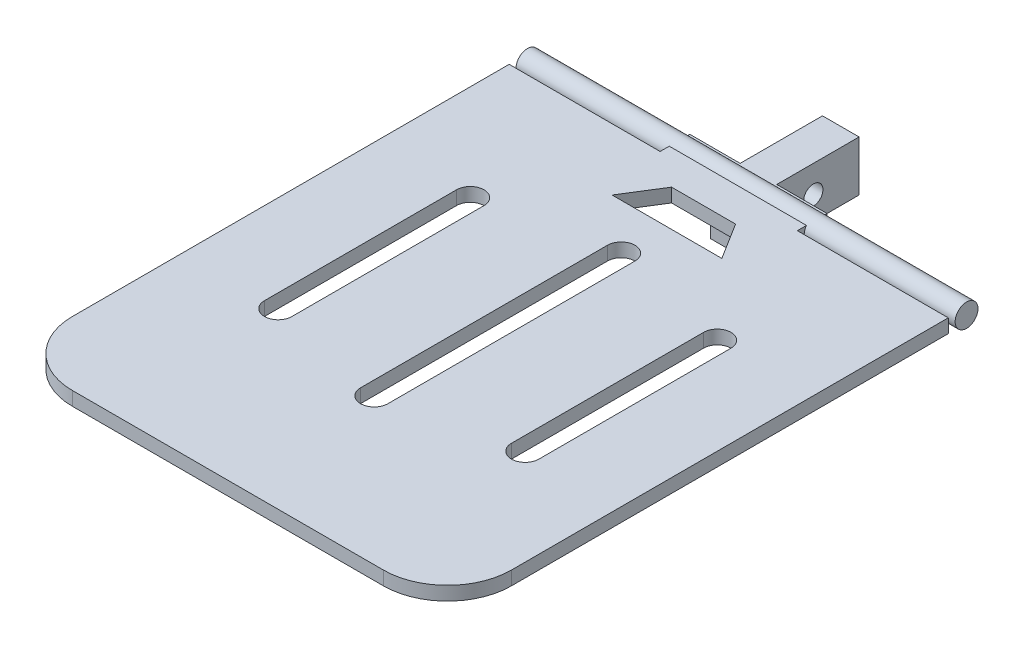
SolidWorks part; units mm, degrees
ref_plane "前视基准面" through (0, 0, 0) normal (0, 0, 1) x (1, 0, 0)
ref_plane "上视基准面" through (0, 0, 0) normal (0, 1, 0) x (1, 0, 0)
ref_plane "右视基准面" through (0, 0, 0) normal (1, 0, 0) x (0, 0, -1)
other "Configuration Table"
ref_plane "Plane_Plate_Mid" through (0, 4.5, 0) normal (0, 1, 0) x (1, 0, 0)
ref_plane "Plane_Tab_Mid" through (0, 0.5, 0) normal (0, 1, 0) x (1, 0, 0)
sketch "草图1" plane through (0, 4.5, 0) normal (0, 1, 0) x (1, 0, 0)
  line L0 (-48, -14.5) -> (48, -14.5)
  line L1 (48, -14.5) -> (48, -110)
  line L2 (34, -124) -> (-34, -124)
  line L3 (-48, -110) -> (-48, -14.5)
  arc A0 (48, -110) -> (34, -124) centre (34, -110) cw
  arc A1 (-34, -124) -> (-48, -110) centre (-34, -110) cw
extrude "01_PLATE_BODY" add sketch "草图1" against normal mid plane 3
sketch "草图2" plane through (0, 0, 0) normal (1, 0, 0) x (0, 0, -1)
  circle A0 centre (-10.5, 4.5) radius 2.5
extrude "02_EDGE_BEAD_D5" add sketch "草图2" against normal mid plane 96
sketch "草图3" plane through (0, 4.5, 0) normal (0, 1, 0) x (1, 0, 0)
  line L1 (-15, -16) -> (15, -16)
  line L2 (-15, -16) -> (-15, -8)
  line L3 (-15, -8) -> (15, -8)
  line L4 (15, -16) -> (15, -8)
extrude "03_WEB" add sketch "草图3" against normal mid plane 3
sketch "草图4" plane through (0, 0.5, 0) normal (0, 1, 0) x (1, 0, 0)
  line L1 (-4, -14.5) -> (4, -14.5)
  line L2 (-4, -14.5) -> (-4, 10)
  line L3 (-4, 10) -> (4, 10)
  line L4 (4, -14.5) -> (4, 10)
extrude "04_TAB" add sketch "草图4" against normal mid plane 11
sketch "草图5" plane through (0, 4.5, 0) normal (0, 1, 0) x (1, 0, 0)
  line L0 (0, -38) -> (0, -92) construction
  line L1 (3, -38) -> (3, -92)
  line L2 (-3, -38) -> (-3, -92)
  arc A0 (3, -38) -> (-3, -38) centre (0, -38) ccw
  arc A1 (-3, -92) -> (3, -92) centre (0, -92) ccw
  point P3 (0, -65)
  point P8 (0, 0)
extrude "05_SLOT_1_F" cut sketch "草图5" along normal through all
sketch "草图6" plane through (0, 4.5, 0) normal (0, 1, 0) x (1, 0, 0)
  line L0 (0, -38) -> (0, -92) construction
  line L1 (3, -38) -> (3, -92)
  line L2 (-3, -38) -> (-3, -92)
  arc A0 (3, -38) -> (-3, -38) centre (0, -38) ccw
  arc A1 (-3, -92) -> (3, -92) centre (0, -92) ccw
  point P3 (0, -65)
  point P8 (0, 0)
extrude "05_SLOT_1_B" cut sketch "草图6" against normal through all
sketch "草图7" plane through (0, 4.5, 0) normal (0, 1, 0) x (1, 0, 0)
  line L0 (-27, -44) -> (-27, -86) construction
  line L1 (-24, -44) -> (-24, -86)
  line L2 (-30, -44) -> (-30, -86)
  arc A0 (-24, -44) -> (-30, -44) centre (-27, -44) ccw
  arc A1 (-30, -86) -> (-24, -86) centre (-27, -86) ccw
  point P2 (-27, -65)
  point P7 (0, 0)
extrude "05_SLOT_2_F" cut sketch "草图7" along normal through all
sketch "草图8" plane through (0, 4.5, 0) normal (0, 1, 0) x (1, 0, 0)
  line L0 (-27, -44) -> (-27, -86) construction
  line L1 (-24, -44) -> (-24, -86)
  line L2 (-30, -44) -> (-30, -86)
  arc A0 (-24, -44) -> (-30, -44) centre (-27, -44) ccw
  arc A1 (-30, -86) -> (-24, -86) centre (-27, -86) ccw
  point P2 (-27, -65)
  point P7 (0, 0)
extrude "05_SLOT_2_B" cut sketch "草图8" against normal through all
sketch "草图9" plane through (0, 4.5, 0) normal (0, 1, 0) x (1, 0, 0)
  line L0 (27, -44) -> (27, -86) construction
  line L1 (30, -44) -> (30, -86)
  line L2 (24, -44) -> (24, -86)
  arc A0 (30, -44) -> (24, -44) centre (27, -44) ccw
  arc A1 (24, -86) -> (30, -86) centre (27, -86) ccw
  point P2 (27, -65)
  point P7 (0, 0)
extrude "05_SLOT_3_F" cut sketch "草图9" along normal through all
sketch "草图10" plane through (0, 4.5, 0) normal (0, 1, 0) x (1, 0, 0)
  line L0 (27, -44) -> (27, -86) construction
  line L1 (30, -44) -> (30, -86)
  line L2 (24, -44) -> (24, -86)
  arc A0 (30, -44) -> (24, -44) centre (27, -44) ccw
  arc A1 (24, -86) -> (30, -86) centre (27, -86) ccw
  point P2 (27, -65)
  point P7 (0, 0)
extrude "05_SLOT_3_B" cut sketch "草图10" against normal through all
sketch "草图11" plane through (0, 4.5, 0) normal (0, 1, 0) x (1, 0, 0)
  line L0 (-7, -20) -> (7, -20)
  line L1 (7, -20) -> (12, -28)
  line L2 (12, -28) -> (-12, -28)
  line L3 (-12, -28) -> (-7, -20)
extrude "06_WINDOW_F" cut sketch "草图11" along normal through all
sketch "草图12" plane through (0, 4.5, 0) normal (0, 1, 0) x (1, 0, 0)
  line L0 (-7, -20) -> (7, -20)
  line L1 (7, -20) -> (12, -28)
  line L2 (12, -28) -> (-12, -28)
  line L3 (-12, -28) -> (-7, -20)
extrude "06_WINDOW_B" cut sketch "草图12" against normal through all
sketch "草图13" plane through (0, 0, 0) normal (1, 0, 0) x (0, 0, -1)
  circle A0 centre (0, 0) radius 2.1
extrude "07_PINHOLE_R" cut sketch "草图13" along normal through all
sketch "草图14" plane through (0, 0, 0) normal (1, 0, 0) x (0, 0, -1)
  circle A0 centre (0, 0) radius 2.1
extrude "07_PINHOLE_L" cut sketch "草图14" against normal through all
